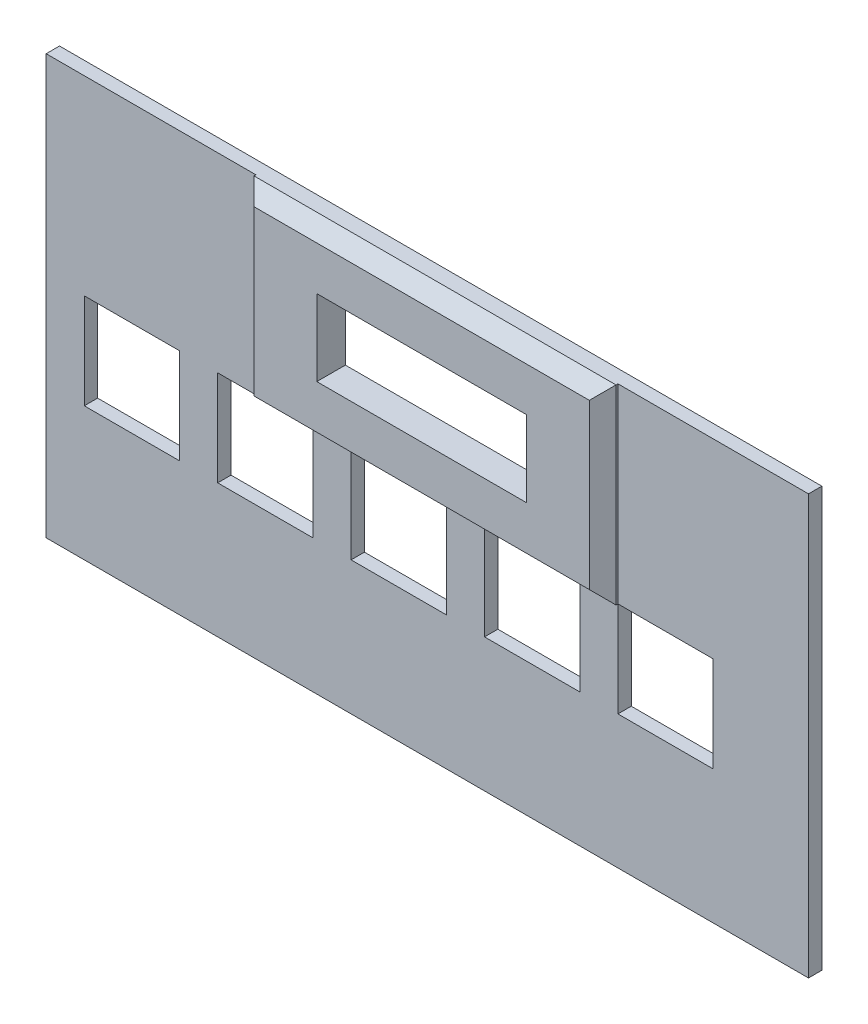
SolidWorks part; units mm, degrees
ref_plane "Front Plane" through (0, 0, 0) normal (0, 0, 1) x (1, 0, 0)
ref_plane "Top Plane" through (0, 0, 0) normal (0, 1, 0) x (1, 0, 0)
ref_plane "Right Plane" through (0, 0, 0) normal (1, 0, 0) x (0, 0, -1)
sketch "Esquisse1" plane through (0, 0, 0) normal (0, 0, 1) x (1, 0, 0)
  line L0 (-70.8995, 122.7684) -> (-70.8995, 100.7684)
  line L1 (-110.8995, 122.7684) -> (-70.8995, 122.7684)
  line L2 (-110.8995, 122.7684) -> (-110.8995, 100.7684)
  line L3 (-70.8995, 100.7684) -> (-110.8995, 100.7684)
  line L4 (-101.8995, 112.7684) -> (-101.8995, 107.7684)
  line L5 (-108.8995, 112.7684) -> (-103.8995, 112.7684)
  line L6 (-108.8995, 112.7684) -> (-108.8995, 107.7684)
  line L7 (-108.8995, 107.7684) -> (-103.8995, 107.7684)
  line L8 (-103.8995, 112.7684) -> (-103.8995, 107.7684)
  line L9 (-101.8995, 112.7684) -> (-96.8995, 112.7684)
  line L10 (-95.8995, 119.7684) -> (-84.8995, 119.7684)
  line L11 (-95.8995, 119.7684) -> (-95.8995, 115.7684)
  line L12 (-95.8995, 115.7684) -> (-84.8995, 115.7684)
  line L13 (-84.8995, 119.7684) -> (-84.8995, 115.7684)
  line L14 (-96.8995, 112.7684) -> (-96.8995, 107.7684)
  line L15 (-101.8995, 107.7684) -> (-96.8995, 107.7684)
  line L16 (-94.8995, 112.7684) -> (-94.8995, 107.7684)
  line L17 (-94.8995, 112.7684) -> (-89.8995, 112.7684)
  line L18 (-89.8995, 112.7684) -> (-89.8995, 107.7684)
  line L19 (-94.8995, 107.7684) -> (-89.8995, 107.7684)
  line L20 (-87.8995, 112.7684) -> (-87.8995, 107.7684)
  line L21 (-87.8995, 112.7684) -> (-82.8995, 112.7684)
  line L22 (-82.8995, 112.7684) -> (-82.8995, 107.7684)
  line L23 (-87.8995, 107.7684) -> (-82.8995, 107.7684)
  line L24 (-80.8995, 112.7684) -> (-80.8995, 107.7684)
  line L25 (-80.8995, 112.7684) -> (-75.8995, 112.7684)
  line L26 (-75.8995, 112.7684) -> (-75.8995, 107.7684)
  line L27 (-80.8995, 107.7684) -> (-75.8995, 107.7684)
  dimension "D1" = 5
  dimension "D2" = 2
  dimension "D5" = 40
  dimension "D6" = 5
  dimension "D3" = 11
  dimension "D4" = 4
  dimension "D7" = 3
  dimension "D8" = 15
  dimension "D9" = 10
extrude "Boss.-Extru.1" add sketch "Esquisse1" along normal mid plane 0.7
sketch "Esquisse2" plane through (0, 0, 0.35) normal (0, 0, 1) x (1, 0, 0)
  line L0 (-99.8995, 122.7684) -> (-99.8995, 112.7684)
  line L1 (-95.8995, 119.7684) -> (-84.8995, 119.7684)
  line L2 (-95.8995, 119.7684) -> (-95.8995, 115.7684)
  line L3 (-95.8995, 115.7684) -> (-84.8995, 115.7684)
  line L4 (-84.8995, 119.7684) -> (-84.8995, 115.7684)
  line L5 (-99.8995, 112.7684) -> (-80.8995, 112.7684)
  line L6 (-80.8995, 122.7684) -> (-80.8995, 112.7684)
  line L7 (-99.8995, 122.7684) -> (-80.8995, 122.7684)
  point P10 (-95.8995, 117.7684)
  point P11 (-99.8995, 117.7684)
  point P12 (-90.3995, 122.7684)
  point P13 (-90.3995, 119.7684)
  dimension "D1" = 4
extrude "Boss.-Extru.2" add sketch "Esquisse2" along normal blind 0.8
chamfer "Chanfrein1" distance 0.7 angle 45 4 edges at (-90.3995, 122.7684, 1.15) (-80.8995, 117.7684, 1.15) (-99.8995, 117.7684, 1.15) (-90.3995, 112.7684, 1.15)
